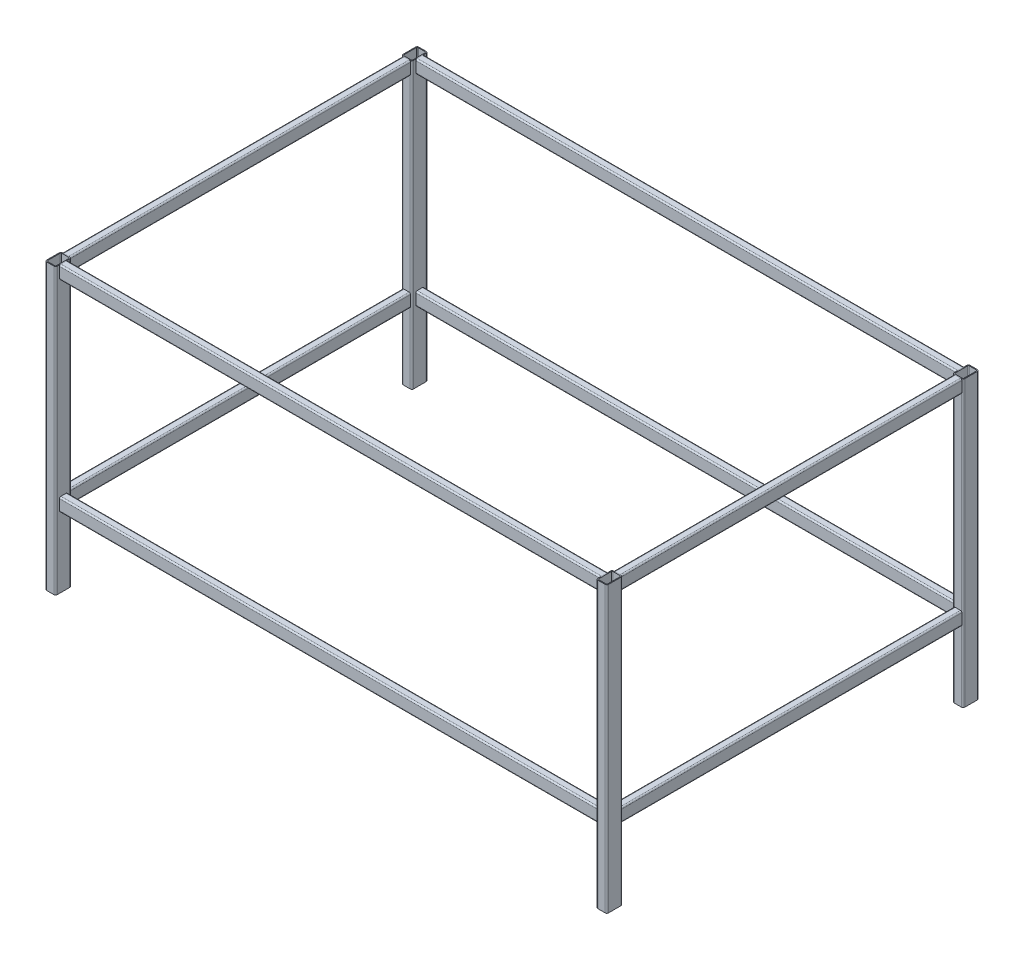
SolidWorks part; units mm, degrees
ref_plane "Front Plane" through (0, 0, 0) normal (0, 0, 1) x (1, 0, 0)
ref_plane "Top Plane" through (0, 0, 0) normal (0, 1, 0) x (1, 0, 0)
ref_plane "Right Plane" through (0, 0, 0) normal (1, 0, 0) x (0, 0, -1)
sketch "Sketch 1" plane through (0, 0, 0) normal (0, 1, 0) x (1, 0, 0)
  line L1 (1041.4, 673.1) -> (-1041.4, 673.1)
  line L2 (1041.4, 673.1) -> (1041.4, -673.1)
  line L3 (1041.4, -673.1) -> (-1041.4, -673.1)
  line L4 (-1041.4, 673.1) -> (-1041.4, -673.1)
  line L5 (1041.4, 673.1) -> (-1041.4, -673.1) construction
  line L6 (1041.4, -673.1) -> (-1041.4, 673.1) construction
  point P0 (0, 0)
  dimension "D1" = 2082.8
  dimension "D2" = 1346.2
sketch3d "3DSketch2"
  line L0 (-1041.4, 0, 673.1) -> (-1041.4, -1050, 673.1)
  line L1 (1041.4, 0, 673.1) -> (1041.4, -1050, 673.1)
  line L2 (1041.4, 0, -673.1) -> (1041.4, -1050, -673.1)
  line L3 (-1041.4, 0, -673.1) -> (-1041.4, -1050, -673.1)
  dimension "D1" = 1050
ref_plane "Plane2" through (0, -760, 0) normal (0, 1, 0) x (1, 0, 0)
other "Structure System1"
sketch3d "Structure System Grid1"
  line L0 (-1041.4, 0, -673.1) -> (-1041.4, -1050, -673.1)
  line L1 (1041.4, 0, -673.1) -> (1041.4, -1050, -673.1)
  line L2 (1041.4, 0, 673.1) -> (1041.4, -1050, 673.1)
  line L3 (-1041.4, 0, 673.1) -> (-1041.4, -1050, 673.1)
  line L4 (-1041.4, 0, 673.1) -> (-1041.4, 0, -673.1)
  line L5 (-1041.4, -760, 673.1) -> (-1041.4, -760, -673.1)
  line L6 (-1041.4, 0, -673.1) -> (1041.4, 0, -673.1)
  line L7 (-1041.4, -760, -673.1) -> (1041.4, -760, -673.1)
  line L8 (1041.4, 0, -673.1) -> (1041.4, 0, 673.1)
  line L9 (1041.4, -760, -673.1) -> (1041.4, -760, 673.1)
  line L10 (1041.4, 0, 673.1) -> (-1041.4, 0, 673.1)
  line L11 (1041.4, -760, 673.1) -> (-1041.4, -760, 673.1)
other "<Tube (1)"
ref_plane "Plane1" through (-1041.4, 0, -673.1) normal (0, -1, 0) x (1, 0, 0)
sketch "Sketch1" plane through (-1041.4, 0, -673.1) normal (0, -1, 0) x (1, 0, 0)
  line L0 (-13.6, -26.8) -> (13.6, -26.8)
  line L1 (-16.8, -23.6) -> (-16.8, 23.6)
  line L2 (13.6, 26.8) -> (-13.6, 26.8)
  line L3 (16.8, 23.6) -> (16.8, -23.6)
  line L4 (-13.6, -30) -> (13.6, -30)
  line L5 (-20, -23.6) -> (-20, 23.6)
  line L6 (13.6, 30) -> (-13.6, 30)
  line L7 (20, 23.6) -> (20, -23.6)
  line L8 (-20, 0) -> (-16.8, 0) construction
  line L9 (-16.8, 0) -> (16.8, 0) construction
  line L10 (16.8, 0) -> (20, 0) construction
  line L11 (0, 30) -> (0, 26.8) construction
  line L12 (0, 26.8) -> (0, -26.8) construction
  line L13 (0, -26.8) -> (0, -30) construction
  arc A0 (20, 23.6) -> (13.6, 30) centre (13.6, 23.6) ccw
  arc A1 (13.6, -30) -> (20, -23.6) centre (13.6, -23.6) ccw
  arc A2 (-20, -23.6) -> (-13.6, -30) centre (-13.6, -23.6) ccw
  arc A3 (-13.6, 30) -> (-20, 23.6) centre (-13.6, 23.6) ccw
  arc A4 (-13.6, 26.8) -> (-16.8, 23.6) centre (-13.6, 23.6) ccw
  arc A5 (16.8, 23.6) -> (13.6, 26.8) centre (13.6, 23.6) ccw
  arc A6 (13.6, -26.8) -> (16.8, -23.6) centre (13.6, -23.6) ccw
  arc A7 (-16.8, -23.6) -> (-13.6, -26.8) centre (-13.6, -23.6) ccw
  point P6 (-20, 30)
  point P33 (-20, -30)
  point P34 (20, -30)
  point P36 (20, 30)
  point P37 (0, 0)
  dimension "D1" = 6.4
  dimension "Thickness" = 3.2
  dimension "V_leg" = 60
  dimension "H_leg" = 40
other "Member1"
other "Member2"
other "Member3"
other "Member4"
other "<Tube (2)"
ref_plane "Plane3" through (-1041.4, 0, 673.1) normal (0, 0, -1) x (-1, 0, 0)
sketch "Sketch11" plane through (-1041.4, 0, 673.1) normal (0, 0, -1) x (-1, 0, 0)
  line L0 (-9.8, -22.4) -> (9.8, -22.4)
  line L1 (-12.4, -19.8) -> (-12.4, 19.8)
  line L2 (9.8, 22.4) -> (-9.8, 22.4)
  line L3 (12.4, 19.8) -> (12.4, -19.8)
  line L4 (-9.8, -25) -> (9.8, -25)
  line L5 (-15, -19.8) -> (-15, 19.8)
  line L6 (9.8, 25) -> (-9.8, 25)
  line L7 (15, 19.8) -> (15, -19.8)
  line L8 (-15, 0) -> (-12.4, 0) construction
  line L9 (-12.4, 0) -> (12.4, 0) construction
  line L10 (12.4, 0) -> (15, 0) construction
  line L11 (0, 25) -> (0, 22.4) construction
  line L12 (0, 22.4) -> (0, -22.4) construction
  line L13 (0, -22.4) -> (0, -25) construction
  arc A0 (15, 19.8) -> (9.8, 25) centre (9.8, 19.8) ccw
  arc A1 (9.8, -25) -> (15, -19.8) centre (9.8, -19.8) ccw
  arc A2 (-15, -19.8) -> (-9.8, -25) centre (-9.8, -19.8) ccw
  arc A3 (-9.8, 25) -> (-15, 19.8) centre (-9.8, 19.8) ccw
  arc A4 (-9.8, 22.4) -> (-12.4, 19.8) centre (-9.8, 19.8) ccw
  arc A5 (12.4, 19.8) -> (9.8, 22.4) centre (9.8, 19.8) ccw
  arc A6 (9.8, -22.4) -> (12.4, -19.8) centre (9.8, -19.8) ccw
  arc A7 (-12.4, -19.8) -> (-9.8, -22.4) centre (-9.8, -19.8) ccw
  point P6 (-15, 25)
  point P33 (-15, -25)
  point P34 (15, -25)
  point P36 (15, 25)
  point P37 (0, 0)
  dimension "D1" = 5.2
  dimension "Thickness" = 2.6
  dimension "V_leg" = 50
  dimension "H_leg" = 30
other "Member5"
other "Member6"
other "Member7"
other "Member8"
other "Member9"
other "Member10"
other "Member11"
other "Member12"
other "Corner Management1"
other "Complex Corner Group1"
other "Corner1"
other "Corner2"
other "Corner3"
other "Corner4"
other "Corner5"
other "Corner6"
other "Corner7"
other "Corner8"
